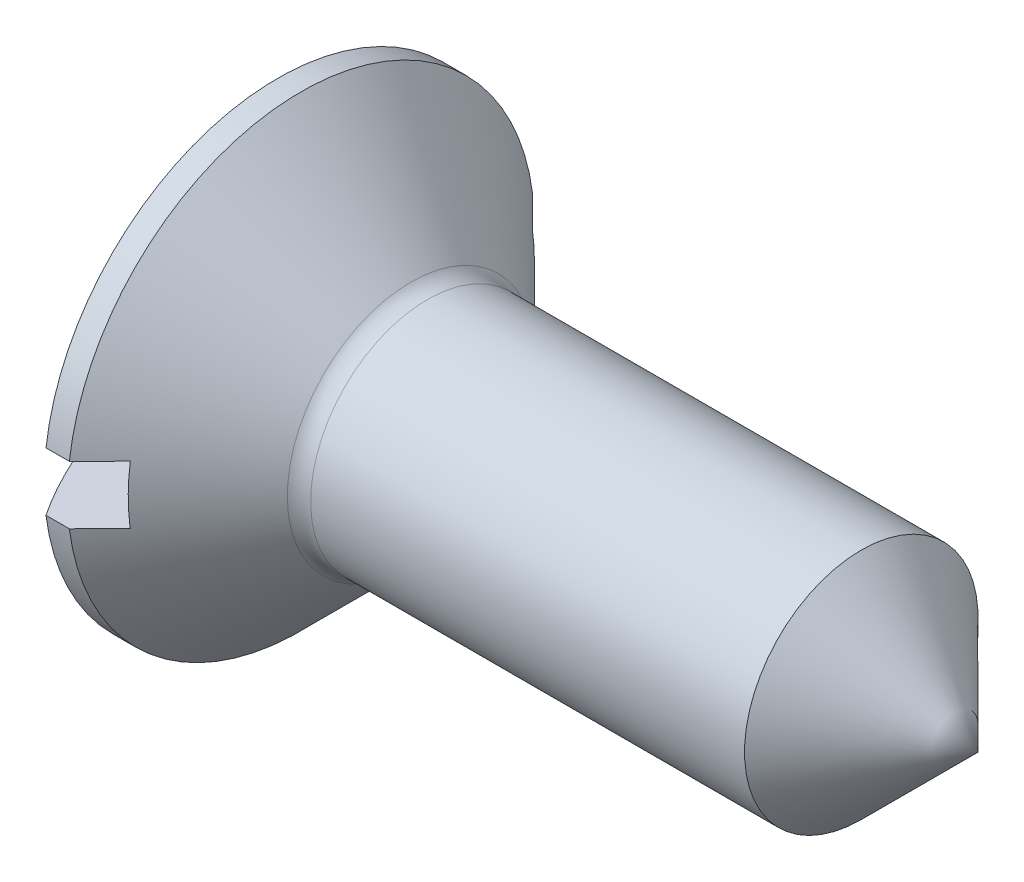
SolidWorks part; units mm, degrees
ref_plane "Front" through (0, 0, 0) normal (0, 0, 1) x (1, 0, 0)
ref_plane "Top" through (0, 0, 0) normal (0, 1, 0) x (1, 0, 0)
ref_plane "Right" through (0, 0, 0) normal (1, 0, 0) x (0, 0, -1)
sketch "Sketch2" plane through (1.6915, 0, 0.5085) normal (0, 1, 0) x (0, 0, -1)
  line L0 (0.5085, -4.3085) -> (0.5085, 2.1079) construction
  line L2 (0.5085, 0.4915) -> (1.5085, 0.4915)
  line L4 (1.5085, 0.4915) -> (2.7085, 1.6915)
  line L5 (2.7085, 1.6915) -> (0.5085, 1.6915)
  line L6 (0.5085, 0.4915) -> (0.5085, 1.6915)
  dimension "D2" = 45
  dimension "k" = 1.2
  dimension "D1" = 1
  dimension "l" = 6
revolve "BaseHead" add sketch "Sketch2" angle 360 about L0
sketch "Sketch1" plane through (1.2, 0.2435, -0.4482) normal (1, 0, 0) x (0, 0, -1)
  circle A0 centre (-0.4482, -0.2435) radius 1
  dimension "d" = 2
extrude "BaseBody" add sketch "Sketch1" along normal blind 4.8
sketch "Sketch3" plane through (0, 0, 0) normal (1, 0, 0) x (0, 0, -1)
  circle A0 centre (0, 0) radius 2
  circle A1 centre (0, 0) radius 2.2 construction
  circle A2 centre (0, 0) radius 2.2
  dimension "dk" = 4
extrude "Cut-Extrude1" cut sketch "Sketch3" along normal through all
sketch "Sketch4" plane through (2.4858, 0, -0.4858) normal (0, 1, 0) x (0, 0, -1)
  line L0 (-0.4858, 0) -> (-0.4858, 2.9717) construction
  line L2 (-0.2358, 3.0858) -> (-0.2358, 2.4858)
  line L3 (1.5142, 2.4858) -> (-2.4858, 2.4858) construction
  line L4 (1.5142, 2.4858) -> (-0.2358, 2.4858)
  arc A0 (-0.2358, 3.0858) -> (1.5142, 2.4858) centre (-0.4892, -0.5052) cw
  dimension "rf" = 3.6
  dimension "n" = 0.5
  dimension "f" = 0.6
revolve "BaseTop" add sketch "Sketch4" angle 360 about L0
sketch "Sketch5" plane through (1.6783, 1.6783, 0) normal (0, 0, 1) x (0, 1, 0)
  line L1 (-1.4283, 1.6783) -> (-1.4283, 2.2783) construction
  line L2 (-1.6783, 0) -> (-1.6783, 3.3566) construction
  line L4 (-1.4283, 1.2183) -> (-1.9283, 1.2183)
  line L5 (-1.4283, 1.2183) -> (-1.4283, 2.2783)
  line L6 (-1.9283, 2.2783) -> (-1.9283, 1.2183)
  line L7 (-1.4283, 2.2783) -> (-1.9283, 2.2783)
  point P9 (-1.6783, 1.2183)
  dimension "t" = 1.06
extrude "Slot" cut sketch "Sketch5" against normal through all and the other way through all
fillet "Fillet1" radius 0.2 1 edges at (1.2, 0, -1)
sketch "Sketch6" plane through (12.7984, -7.2016, 0) normal (0, 0, 1) x (0, 1, 0)
  line L0 (7.2016, -3.8376) -> (7.2016, -8.4033) construction
  line L2 (7.2016, 6.0537) -> (27.2016, 6.0537)
  line L3 (27.2016, 6.0537) -> (27.2016, 26.7984)
  line L4 (27.2016, 26.7984) -> (7.2016, 6.7984)
  line L5 (7.2016, 6.7984) -> (7.2016, 6.0537)
  line L7 (6.2016, 6.7984) -> (8.2016, 6.7984) construction
  dimension "D1" = 45
  dimension "D2" = 20
  dimension "D3" = 0.7447
revolve "Cut-Revolve1" cut sketch "Sketch6" angle 360 about L0
sketch "Sketch8" plane through (0, 0, 0) normal (0, 0, 1) x (1, 0, 0)
  line L0 (2, 1.2) -> (2.25, 1.2)
  line L1 (2.25, 1.2) -> (2.25, 1)
  line L2 (2.25, 1) -> (2.125, 0.7835)
  line L3 (2, 1) -> (2.125, 0.7835)
  line L4 (2, 1.2) -> (2, 1)
  line L5 (21.5487, 0) -> (0, 0) construction
  line L6 (2, 1) -> (2.25, 1) construction
  line L7 (2.125, 1) -> (2.125, 0.7835) construction
  line L9 (5, 1) -> (1.2828, 1) construction
  point P6 (2.125, 1.2)
  dimension "D1" = 0.2
  dimension "D2" = 0.25
  dimension "D3" = 4
revolve "Cut-Revolve10" [suppressed] cut sketch "Sketch8" angle 360 about L5
pattern_linear "LPattern10" [suppressed] count 8 spacing 0.5
equation "\"D1@Sketch2\" = \"d@Sketch1\" / 2"
equation "\"D2@Sketch8\" = (  \"d@Sketch1\" - \"dm@ThreadCosmetic1\" )  / 2"
equation "\"D3@Sketch8\" = \"D1@ThreadCosmetic1\" + \"d@Sketch1\" / 2"
equation "\"D3@LPattern10\" = \"D2@Sketch8\" * 2"
equation "\"D1@LPattern10\" = \"D3@Sketch8\" / \"D3@LPattern10\""
equation "\"l@BaseBody\" = \"l@Sketch2\" - \"k@Sketch2\""
